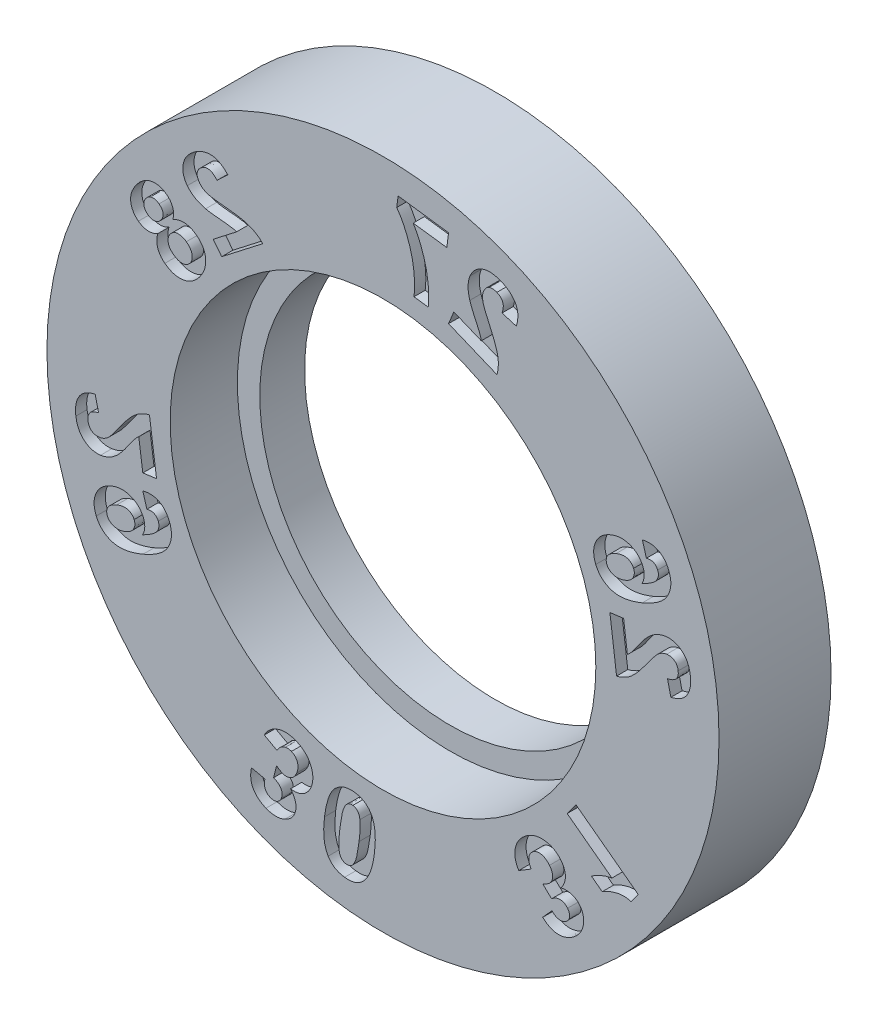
SolidWorks part; units mm, degrees
ref_plane "Front Plane" through (0, 0, 0) normal (0, 0, 1) x (1, 0, 0)
ref_plane "Top Plane" through (0, 0, 0) normal (0, 1, 0) x (1, 0, 0)
ref_plane "Right Plane" through (0, 0, 0) normal (1, 0, 0) x (0, 0, -1)
imported_body "Imported1"
other "DeleteFace3"
sketch "Sketch1" plane through (0, 0, 0) normal (0, 0, 1) x (1, 0, 0)
  line L0 (0, 0) -> (0, 16.3507) construction
  line L1 (0, 0) -> (14.1601, 8.1754) construction
  line L2 (0, 0) -> (14.1601, -8.1754) construction
  line L3 (0, 0) -> (0, -16.3507) construction
  line L4 (0, 0) -> (-14.1601, -8.1754) construction
  line L5 (0, 0) -> (-14.1601, 8.1754) construction
  circle A0 centre (0, 0) radius 10.4416 construction
  text T0 "26    27    28    29    30    31" font "Arial" height 3.5
  point P11 (0, 0)
  dimension "D1" = 6
extrude "Cut-Extrude1" cut sketch "Sketch1" against normal blind 0.5
